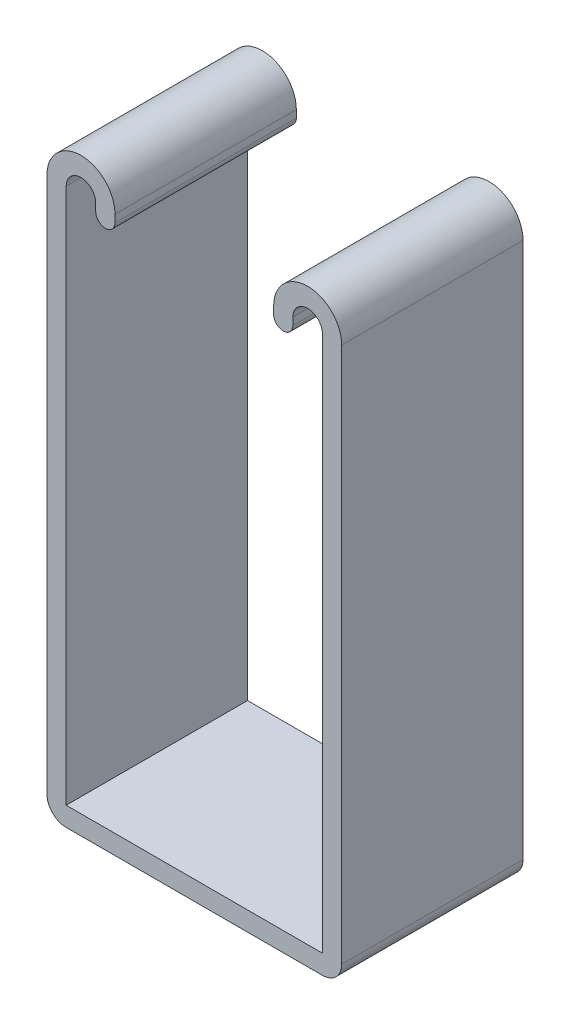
SolidWorks part; units mm, degrees
ref_plane "Plane1" through (0, 0, 0) normal (0, 0, 1) x (1, 0, 0)
ref_plane "Plane2" through (0, 0, 0) normal (0, 1, 0) x (1, 0, 0)
ref_plane "Plane3" through (0, 0, 0) normal (1, 0, 0) x (0, 0, -1)
sketch "Sketch1" plane through (0, 0, 0) normal (0, 0, 1) x (1, 0, 0)
  line L0 (-20.6375, 39.6875) -> (-20.6375, -35.4076)
  line L1 (-17.9451, -38.1) -> (17.9451, -38.1)
  line L2 (20.6375, -35.4076) -> (20.6375, 39.6875)
  line L3 (11.1125, 39.6875) -> (11.1125, 38.6524)
  line L4 (-11.1125, 39.6875) -> (-11.1125, 38.6524)
  line L5 (-13.8049, 39.6875) -> (-13.8049, 38.6524)
  line L6 (-17.9451, 39.6875) -> (-17.9451, -35.4076)
  line L7 (-17.9451, -35.4076) -> (17.9451, -35.4076)
  line L8 (17.9451, -35.4076) -> (17.9451, 39.6875)
  line L9 (13.8049, 39.6875) -> (13.8049, 38.6524)
  line L10 (-25.4, 44.45) -> (25.4, 44.45) construction
  line L11 (-12.8524, 37.3062) -> (12.8524, 37.3062) construction
  arc A0 (20.6375, 39.6875) -> (11.1125, 39.6875) centre (15.875, 39.6875) ccw
  arc A1 (-20.6375, 39.6875) -> (-11.1125, 39.6875) centre (-15.875, 39.6875) cw
  arc A2 (-17.9451, -38.1) -> (-20.6375, -35.4076) centre (-17.9451, -35.4076) cw
  arc A3 (17.9451, -38.1) -> (20.6375, -35.4076) centre (17.9451, -35.4076) ccw
  arc A4 (-17.9451, 39.6875) -> (-13.8049, 39.6875) centre (-15.875, 39.6875) cw
  arc A5 (17.9451, 39.6875) -> (13.8049, 39.6875) centre (15.875, 39.6875) ccw
  arc A6 (11.1125, 38.6524) -> (13.8049, 38.6524) centre (12.4587, 38.6524) ccw
  arc A7 (-11.1125, 38.6524) -> (-13.8049, 38.6524) centre (-12.4587, 38.6524) cw
  dimension "D1" = 2.6924
  dimension "D3" = 20.6375
  dimension "Width" = 41.275
  dimension "D5" = 38.1
  dimension "D6" = 9.525
  dimension "D7" = 22.225
  dimension "D8" = 44.45
  dimension "D9" = 7.1437
  dimension "gauge" = 2.6924
extrude "Base-Extrude" add sketch "Sketch1" along normal mid plane 25.4
equation "\"D3@Sketch1\" = \"Width@Sketch1\" / 2"
equation "\"D7@Sketch1\" = \"Width@Sketch1\" - 2 * \"D6@Sketch1\""
equation "\"D1@Sketch1\" = \"gauge@Sketch1\""
